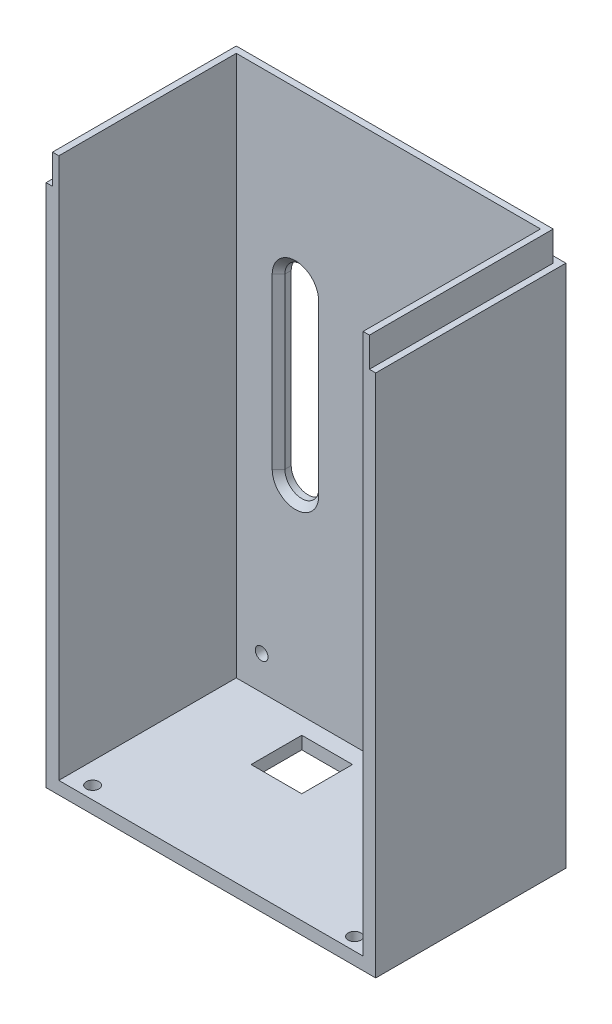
SolidWorks part; units mm, degrees
ref_plane "Front Plane" through (0, 0, 0) normal (0, 0, 1) x (1, 0, 0)
ref_plane "Top Plane" through (0, 0, 0) normal (0, 1, 0) x (1, 0, 0)
ref_plane "Right Plane" through (0, 0, 0) normal (1, 0, 0) x (0, 0, -1)
sketch "Sketch2" plane through (0, 0, 0) normal (0, 0, 1) x (1, 0, 0)
  line L1 (-39, 128) -> (39, 128)
  line L2 (-39, 128) -> (-39, -128)
  line L3 (-39, -128) -> (39, -128)
  line L4 (39, 128) -> (39, -128)
  line L5 (-39, 128) -> (39, -128) construction
  line L6 (-39, -128) -> (39, 128) construction
  point P0 (0, 0)
  dimension "D1" = 256
  dimension "D2" = 78
extrude "Boss-Extrude1" add sketch "Sketch2" along normal blind 3
sketch "Sketch3" plane through (0, 0, 3) normal (0, 0, 1) x (1, 0, 0)
  line L8 (36, -125) -> (36, 125)
  line L9 (36, 125) -> (-36, 125)
  line L10 (-36, 125) -> (-36, -125)
  line L11 (-36, -125) -> (36, -125)
  line L12 (36, -125) -> (36, 125)
  line L13 (36, 125) -> (-36, 125)
  line L14 (-36, 125) -> (-36, -125)
  line L15 (-36, -125) -> (36, -125)
  line L16 (-39, 128) -> (-39, -128)
  line L17 (-39, -128) -> (39, -128)
  line L18 (39, -128) -> (39, 128)
  line L19 (39, 128) -> (-39, 128)
  dimension "D1" = 3
  dimension "D2" = 3
extrude "Boss-Extrude2" add sketch "Sketch3" along normal blind 42
sketch "Sketch4" plane through (0, -128, 0) normal (0, -1, 0) x (1, 0, 0)
  line L5 (-16.5, 7) -> (-16.5, 19)
  line L6 (-16.5, 19) -> (-4.5, 19)
  line L7 (-4.5, 19) -> (-4.5, 7)
  line L9 (24, 7) -> (24, 18)
  line L10 (24, 18) -> (14.5, 18)
  line L11 (14.5, 18) -> (14.5, 7)
  line L13 (14.5, 7) -> (24, 7)
  line L14 (-16.5, 7) -> (-4.5, 7)
  line L15 (39, 45) -> (39, 0) construction
  line L16 (-39, 45) -> (39, 45) construction
  dimension "D1" = 26
  dimension "D2" = 12
  dimension "D3" = 12
  dimension "D4" = 15
  dimension "D5" = 19
  dimension "D7" = 11
  dimension "D8" = 9.5
extrude "Cut-Extrude3" cut sketch "Sketch4" against normal blind 7
sketch "Sketch6" plane through (-39, 0, 0) normal (-1, 0, 0) x (0, 0, 1)
  line L0 (45, 128) -> (0, 128) construction
  line L1 (0, 128) -> (0, -128) construction
  line L3 (6, 68) -> (17, 68)
  line L4 (6, 68) -> (6, 53)
  line L6 (6, 53) -> (17, 53)
  line L7 (17, 68) -> (17, 53)
  dimension "D1" = 60
  dimension "D2" = 15
  dimension "D3" = 11
  dimension "D4" = 6
extrude "Cut-Extrude4" cut sketch "Sketch6" against normal blind 6
sketch "Sketch9" plane through (0, -128, 0) normal (0, -1, 0) x (1, 0, 0)
  line L0 (-39, 45) -> (-39, 0) construction
  line L1 (39, 45) -> (39, 0) construction
  line L2 (-39, 45) -> (39, 45) construction
  circle A0 centre (-31, 42) radius 1.5
  circle A1 centre (31, 42) radius 1.5
  dimension "D3" = 3
  dimension "D4" = 3
  dimension "D1" = 8
  dimension "8" = 8
  dimension "D2" = 3
extrude "Cut-Extrude6" cut sketch "Sketch9" against normal through all
sketch "Sketch14" plane through (0, 0, 0) normal (0, 0, -1) x (-1, 0, 0)
  line L4 (22, 99.1122) -> (22, 59.1122) construction
  line L5 (26, 99.1122) -> (26, 59.1122)
  line L6 (18, 99.1122) -> (18, 59.1122)
  line L7 (-22, 99.1122) -> (-22, 59.1122) construction
  line L8 (-18, 99.1122) -> (-18, 59.1122)
  line L9 (-26, 99.1122) -> (-26, 59.1122)
  line L10 (22, -38) -> (22, -78) construction
  line L11 (26, -38) -> (26, -78)
  line L12 (18, -38) -> (18, -78)
  line L13 (-22, -38) -> (-22, -78) construction
  line L14 (-18, -38) -> (-18, -78)
  line L15 (-26, -38) -> (-26, -78)
  line L16 (39, -128) -> (-39, -128) construction
  arc A0 (26, 99.1122) -> (18, 99.1122) centre (22, 99.1122) ccw
  arc A1 (18, 59.1122) -> (26, 59.1122) centre (22, 59.1122) ccw
  arc A2 (-18, 99.1122) -> (-26, 99.1122) centre (-22, 99.1122) ccw
  arc A3 (-26, 59.1122) -> (-18, 59.1122) centre (-22, 59.1122) ccw
  arc A4 (26, -38) -> (18, -38) centre (22, -38) ccw
  arc A5 (18, -78) -> (26, -78) centre (22, -78) ccw
  arc A6 (-18, -38) -> (-26, -38) centre (-22, -38) ccw
  arc A7 (-26, -78) -> (-18, -78) centre (-22, -78) ccw
  point P10 (22, 79.1122)
  point P15 (-22, 79.1122)
  point P22 (22, -58)
  point P29 (-22, -58)
  dimension "D4" = 4
  dimension "D3" = 40
  dimension "D5" = 50
extrude "Cut-Extrude8" cut sketch "Sketch14" against normal through all
sketch "Sketch16" plane through (0, 0, 0) normal (0, 0, -1) x (-1, 0, 0)
  line L0 (30, 160.4835) -> (30, -164.8694) construction
  line L1 (-30, 219.4493) -> (-30, -244.1456) construction
  line L2 (39, 128) -> (39, -128) construction
  line L3 (-39, 128) -> (39, 128) construction
  line L4 (39, -128) -> (-39, -128) construction
  line L5 (-39, -128) -> (-39, 128) construction
  circle A0 centre (30, 117) radius 1.5
  circle A1 centre (-30, 117) radius 1.5
  circle A2 centre (30, -117) radius 1.5
  circle A3 centre (-30, -117) radius 1.5
  dimension "D3" = 3
  dimension "D4" = 11
  dimension "D7" = 11
  dimension "D1" = 9
  dimension "D2" = 9
  dimension "D5" = 11
  dimension "D6" = 11
extrude "Cut-Extrude9" cut sketch "Sketch16" against normal through all
sketch "Sketch19" plane through (0, 128, 0) normal (0, 1, 0) x (1, 0, 0)
  line L0 (39, -45) -> (-39, -45) construction
  line L1 (39, 0) -> (-39, 0) construction
  line L9 (-18, -35) -> (-18, -7)
  line L10 (-18, -7) -> (19, -7)
  line L11 (19, -7) -> (19, -35)
  line L12 (19, -35) -> (-18, -35)
  dimension "D1" = 10
  dimension "D2" = 7
  dimension "D3" = 37
extrude "Cut-Extrude11" cut sketch "Sketch19" against normal blind 15
sketch "Sketch25" plane through (0, 128, 0) normal (0, 1, 0) x (1, 0, 0)
  line L0 (0, 0) -> (0, -50000) construction
  line L1 (-0.5425, -25) -> (49999.4575, -25) construction
  line L2 (-39, -45) -> (-39, 0) construction
  line L3 (-35, -35) -> (-28, -35)
  line L4 (-35, -35) -> (-35, -15)
  line L5 (-35, -15) -> (-28, -15)
  line L6 (-28, -35) -> (-28, -15)
  line L7 (-35, -35) -> (-28, -15) construction
  line L8 (-35, -15) -> (-28, -35) construction
  line L9 (28, -15) -> (35, -15)
  line L10 (28, -15) -> (28, -35)
  line L11 (28, -35) -> (35, -35)
  line L12 (35, -15) -> (35, -35)
  line L13 (28, -15) -> (35, -35) construction
  line L14 (28, -35) -> (35, -15) construction
  line L15 (39, 0) -> (-39, 0) construction
  line L16 (39, -45) -> (39, 0) construction
  point P5 (-31.5, -25)
  point P10 (31.5, -25)
  dimension "D1" = 7
  dimension "D2" = 20
  dimension "D3" = 4
  dimension "D4" = 4
  dimension "D5" = 7
  dimension "D6" = 20
  dimension "D7" = 15
extrude "Cut-Extrude16" cut sketch "Sketch25" against normal blind 4
sketch "Sketch27" plane through (0, 128, 0) normal (0, 1, 0) x (1, 0, 0)
  circle A0 centre (-21.5044, -8) radius 1.5
  circle A1 centre (24.5044, -8) radius 1.5
  circle A2 centre (-21.5044, -35) radius 1.5
  circle A3 centre (24.5044, -35) radius 1.5
extrude "Cut-Extrude17" cut sketch "Sketch27" against normal blind 10
sketch "Sketch29" plane through (0, 0, 3) normal (0, 0, 1) x (1, 0, 0)
  line L0 (-39, 128) -> (39, 128)
  line L1 (39, 128) -> (39, 3)
  line L2 (39, -128) -> (39, 128) construction
  line L3 (39, 3) -> (36, 3)
  line L4 (36, -125) -> (36, 125) construction
  line L5 (36, 3) -> (-39, 3)
  line L6 (-39, 128) -> (-39, -128) construction
  line L7 (-39, 3) -> (-39, 128)
  dimension "D1" = 125
extrude "Cut-Extrude18" cut sketch "Sketch29" along normal through all
sketch "Sketch30" plane through (0, 0, 3) normal (0, 0, 1) x (1, 0, 0)
  line L0 (-39, 128) -> (39, 128)
  line L1 (39, 128) -> (39, 3)
  line L2 (39, 3) -> (-39, 3)
  line L3 (-39, 128) -> (-39, 3) construction
  line L4 (-39, 3) -> (-36, 3) construction
  line L5 (-39, 3) -> (-39, 128)
extrude "Cut-Extrude19" cut sketch "Sketch30" against normal through all
sketch "Sketch31" plane through (0, 0, 3) normal (0, 0, 1) x (1, 0, 0)
  line L0 (-39, 3) -> (-37.5, 3)
  line L1 (-39, 3) -> (-36, 3) construction
  line L2 (-37.5, 3) -> (-37.5, -4)
  line L3 (-37.5, -4) -> (-39, -4)
  line L4 (-39, 3) -> (-39, -128) construction
  line L5 (-39, -4) -> (-39, 3)
  line L6 (39, 3) -> (37.5, 3)
  line L7 (36, 3) -> (39, 3) construction
  line L8 (37.5, 3) -> (37.5, -4)
  line L9 (37.5, -4) -> (39, -4)
  line L10 (39, -128) -> (39, 3) construction
  line L11 (39, -4) -> (39, 3)
  dimension "D1" = 7
  dimension "D2" = 7
extrude "Cut-Extrude20" cut sketch "Sketch31" along normal through all
sketch "Sketch34" plane through (0, 3, 0) normal (0, 1, 0) x (1, 0, 0)
  line L1 (-39, 0) -> (39, 0) construction
  line L4 (39, 0) -> (-39, 0)
  line L5 (-39, 0) -> (-39, -1.5)
  line L7 (-37.5, -1.5) -> (37.5, -1.5)
  line L8 (39, -1.5) -> (39, 0)
  line L9 (-39, -1.5) -> (-39, -3)
  line L10 (-39, -3) -> (-37.5, -3)
  line L11 (-37.5, -3) -> (-37.5, -1.5)
  line L12 (39, -3) -> (39, -1.5)
  line L13 (39, -3) -> (37.5, -3)
  line L14 (37.5, -3) -> (37.5, -1.5)
extrude "Cut-Extrude24" cut sketch "Sketch34" against normal blind 7
chamfer "Chamfer1" distance 1.5 angle 45 4 edges at (-26, -58, 3) (-22, -82, 3) (-22, -34, 3) (-18, -58, 3)
chamfer "Chamfer2" distance 1.5 angle 45 4 edges at (26, -58, 0) (22, -82, 0) (22, -34, 0) (18, -58, 0)
